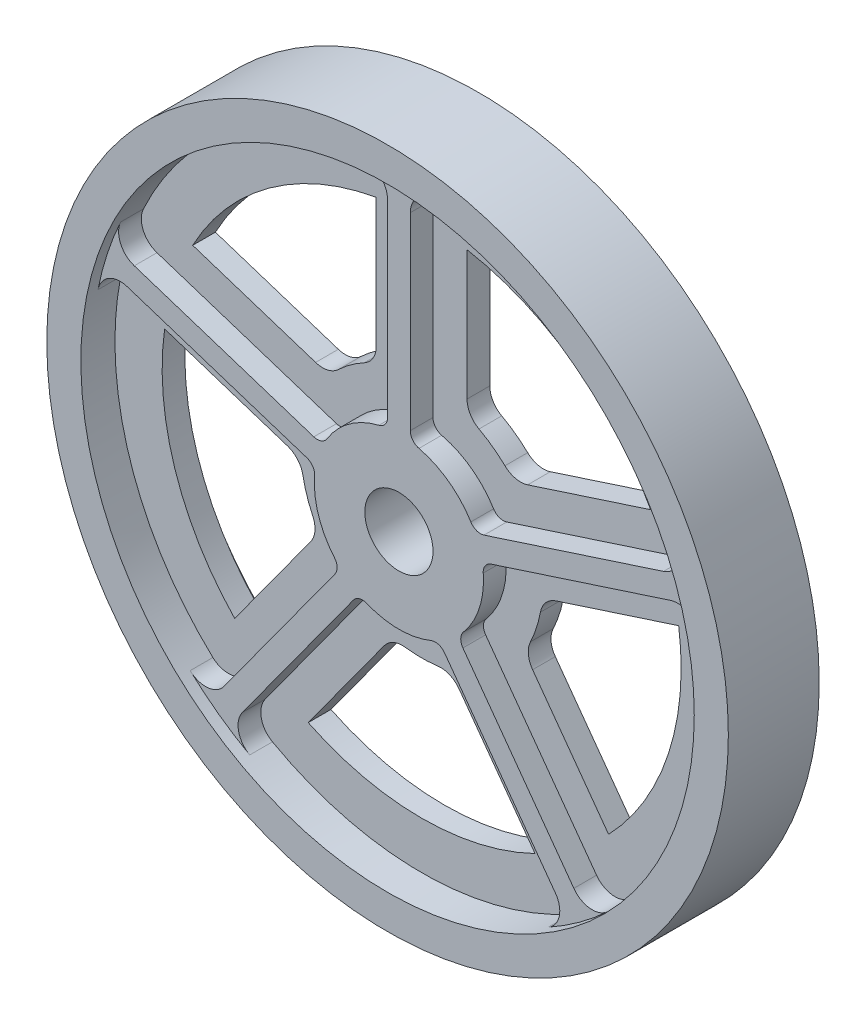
SolidWorks part; units mm, degrees
ref_plane "Alzado" through (0, 0, 0) normal (0, 0, 1) x (1, 0, 0)
ref_plane "Planta" through (0, 0, 0) normal (0, 1, 0) x (1, 0, 0)
ref_plane "Vista lateral" through (0, 0, 0) normal (1, 0, 0) x (0, 0, -1)
sketch "Croquis1" plane through (0, 0, 0) normal (0, 0, 1) x (1, 0, 0)
  circle A0 centre (0, 0) radius 150
  circle A1 centre (0, 0) radius 135
  dimension "D1" = 300
  dimension "D2" = 270
extrude "Extruir1" add sketch "Croquis1" along normal mid plane 40
sketch "Croquis4" plane through (0, 0, 0) normal (0, 0, 1) x (1, 0, 0)
  circle A0 centre (0, 0) radius 114.2243
  circle A1 centre (0, 0) radius 138.3911
extrude "Extruir4" add sketch "Croquis4" along normal mid plane 10
sketch "Croquis2" plane through (0, 0, 0) normal (0, 0, 1) x (1, 0, 0)
  line L0 (59.0279, -1.8499) -> (136.4164, 23.2951)
  line L1 (20, 55.5672) -> (20, 136.9383)
  line L2 (-20, 55.5672) -> (-20, 136.9383)
  line L3 (46.6672, 36.1923) -> (124.0558, 61.3374)
  line L4 (16.4813, -56.7105) -> (64.31, -122.5412)
  line L5 (48.8419, -33.1991) -> (96.6707, -99.0297)
  line L6 (-48.8419, -33.1991) -> (-96.6707, -99.0297)
  line L7 (-16.4813, -56.7105) -> (-64.31, -122.5412)
  line L8 (-46.6672, 36.1923) -> (-124.0558, 61.3374)
  line L9 (-59.0279, -1.8499) -> (-136.4164, 23.2951)
  arc A0 (-25.2493, 46.7677) -> (-36.6763, 38.4655) centre (0, 0) ccw
  arc A1 (20, 136.9383) -> (-20, 136.9383) centre (0, 0) ccw
  arc A2 (25.2493, 46.7677) -> (20, 55.5672) centre (30, 55.5672) cw
  arc A3 (-25.2493, 46.7677) -> (-20, 55.5672) centre (-30, 55.5672) ccw
  arc A4 (136.4164, 23.2951) -> (124.0558, 61.3374) centre (0, 0) ccw
  arc A5 (52.2812, -9.5615) -> (59.0279, -1.8499) centre (62.1181, -11.3605) cw
  arc A6 (36.6763, 38.4655) -> (46.6672, 36.1923) centre (43.5771, 45.7029) ccw
  arc A7 (64.31, -122.5412) -> (96.6707, -99.0297) centre (0, 0) ccw
  arc A8 (7.0623, -52.6771) -> (16.4813, -56.7105) centre (8.3911, -62.5884) cw
  arc A9 (47.9165, -22.9947) -> (48.8419, -33.1991) centre (56.9321, -27.3213) ccw
  arc A10 (-96.6707, -99.0297) -> (-64.31, -122.5412) centre (0, 0) ccw
  arc A11 (-47.9165, -22.9947) -> (-48.8419, -33.1991) centre (-56.9321, -27.3213) cw
  arc A12 (-7.0623, -52.6771) -> (-16.4813, -56.7105) centre (-8.3911, -62.5884) ccw
  arc A13 (-124.0558, 61.3374) -> (-136.4164, 23.2951) centre (0, 0) ccw
  arc A14 (-36.6763, 38.4655) -> (-46.6672, 36.1923) centre (-43.5771, 45.7029) cw
  arc A15 (-52.2812, -9.5615) -> (-59.0279, -1.8499) centre (-62.1181, -11.3605) ccw
  arc A16 (-52.2812, -9.5615) -> (-47.9165, -22.9947) centre (0, 0) ccw
  arc A17 (-7.0623, -52.6771) -> (7.0623, -52.6771) centre (0, 0) ccw
  arc A18 (47.9165, -22.9947) -> (52.2812, -9.5615) centre (0, 0) ccw
  arc A19 (36.6763, 38.4655) -> (25.2493, 46.7677) centre (0, 0) ccw
  point P3 (20, 0)
  point P4 (0, 142.4992)
  point P5 (20, 142.4992)
  point P6 (-20, 0)
  point P7 (-20, 142.4992)
  dimension "D3" = 10
extrude "Extruir5" add sketch "Croquis2" along normal mid plane 10
sketch "Croquis5" plane through (0, 0, 5) normal (0, 0, 1) x (1, 0, 0)
  line L0 (37.4669, 17.4311) -> (126.8475, 46.4726)
  line L1 (5, 41.0197) -> (5, 135)
  line L2 (-5, 41.0197) -> (-5, 135)
  line L3 (40.5571, 7.9205) -> (129.9377, 36.962)
  line L4 (28.1558, -30.2467) -> (83.3961, -106.2784)
  line L5 (20.0657, -36.1245) -> (75.3059, -112.1562)
  line L6 (-20.0657, -36.1245) -> (-75.3059, -112.1562)
  line L7 (-28.1558, -30.2467) -> (-83.3961, -106.2784)
  line L8 (-40.5571, 7.9205) -> (-129.9377, 36.962)
  line L9 (-37.4669, 17.4311) -> (-126.8475, 46.4726)
  arc A0 (-8.8158, 36.1619) -> (-31.6678, 19.5589) centre (0, 0) ccw
  arc A2 (5, 134.9074) -> (-5, 134.9074) centre (0, 0) ccw
  arc A3 (129.8496, 36.9334) -> (126.7595, 46.444) centre (0, 0) ccw
  arc A4 (75.2515, -112.0813) -> (83.3417, -106.2034) centre (0, 0) ccw
  arc A5 (-83.3417, -106.2034) -> (-75.2515, -112.0813) centre (0, 0) ccw
  arc A6 (-126.7595, 46.444) -> (-129.8496, 36.9334) centre (0, 0) ccw
  arc A7 (-37.1163, 2.7904) -> (-28.3876, -24.0739) centre (0, 0) ccw
  arc A8 (-14.1234, -34.4374) -> (14.1234, -34.4374) centre (0, 0) ccw
  arc A9 (28.3876, -24.0739) -> (37.1163, 2.7904) centre (0, 0) ccw
  arc A10 (31.6678, 19.5589) -> (8.8158, 36.1619) centre (0, 0) ccw
  arc A11 (-14.1234, -34.4374) -> (-20.0657, -36.1245) centre (-16.0206, -39.0635) ccw
  arc A12 (-28.1558, -30.2467) -> (-28.3876, -24.0739) centre (-32.2009, -27.3078) ccw
  arc A13 (-37.1163, 2.7904) -> (-40.5571, 7.9205) centre (-42.1022, 3.1652) ccw
  arc A14 (-31.6678, 19.5589) -> (-37.4669, 17.4311) centre (-35.9219, 22.1863) cw
  arc A15 (20.0657, -36.1245) -> (14.1234, -34.4374) centre (16.0206, -39.0635) ccw
  arc A16 (28.3876, -24.0739) -> (28.1558, -30.2467) centre (32.2009, -27.3078) ccw
  arc A17 (40.5571, 7.9205) -> (37.1163, 2.7904) centre (42.1022, 3.1652) ccw
  arc A18 (31.6678, 19.5589) -> (37.4669, 17.4311) centre (35.9219, 22.1863) ccw
  arc A19 (5, 41.0197) -> (8.8158, 36.1619) centre (10, 41.0197) ccw
  arc A20 (-8.8158, 36.1619) -> (-5, 41.0197) centre (-10, 41.0197) ccw
  point P4 (0, 135)
  dimension "D1" = 5
extrude "Extruir6" add sketch "Croquis5" along normal blind 10 contours A20 A0 A14 L9 L8 A13 A7 A12 L7 L6 A11 A8 A15 L5 L4 A16 A9 A17 L3 L0 A18 A10 A19 L1 L2 M7
fillet "Redondeo2" radius 10 1 edges at (-126.7595, 46.444, 10)
fillet "Redondeo3" radius 10 1 edges at (-129.8496, 36.9334, 10)
fillet "Redondeo4" radius 10 8 edges at (-75.2515, -112.0813, 10) (-83.3417, -106.2034, 10) (83.3417, -106.2034, 10) (75.2515, -112.0813, 10) (126.7595, 46.444, 10) (129.8496, 36.9334, 10) (-5, 134.9074, 10) (5, 134.9074, 10)
mirror "Simetría1" about plane through (0, 0, 0) normal (0, 0, 1) of "Redondeo2", "Redondeo4", "Redondeo3", "Extruir6"
sketch "Croquis6" plane through (0, 0, -15) normal (0, 0, -1) x (-1, 0, 0)
  circle A0 centre (0, 0) radius 15
  dimension "D1" = 30
extrude "Extruir7" cut sketch "Croquis6" against normal through all
